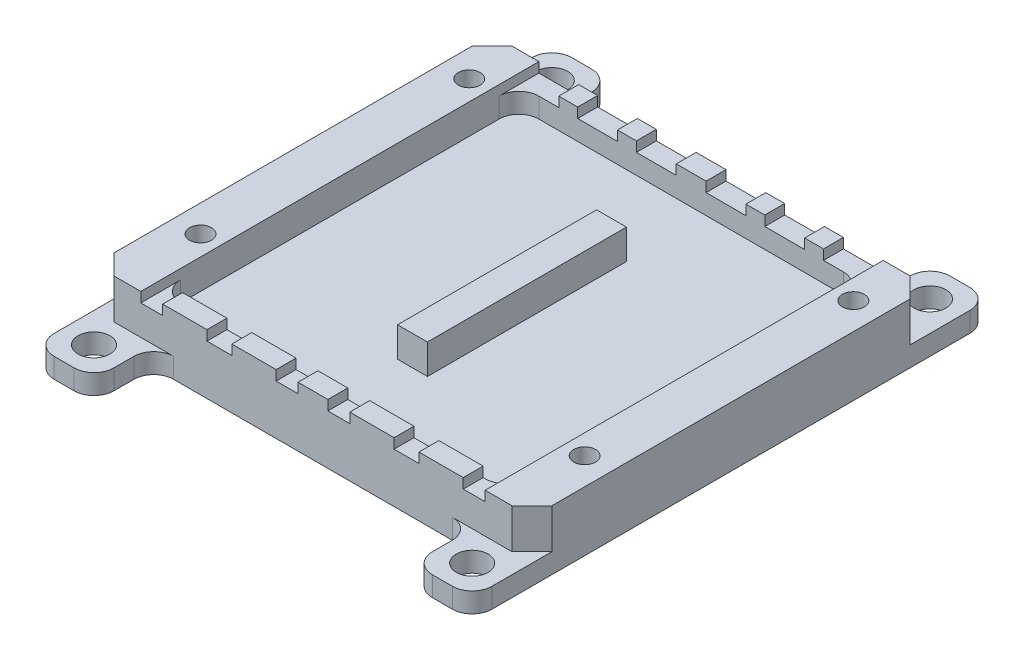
SolidWorks part; units mm, degrees
ref_plane "前视基准面" through (0, 0, 0) normal (0, 0, 1) x (1, 0, 0)
ref_plane "上视基准面" through (0, 0, 0) normal (0, 1, 0) x (1, 0, 0)
ref_plane "右视基准面" through (0, 0, 0) normal (1, 0, 0) x (0, 0, -1)
sketch "草图1" plane through (0, 0, 0) normal (0, 1, 0) x (1, 0, 0)
  line L0 (-37.9487, 0) -> (36.8091, 0) construction
  line L1 (0, 33.7892) -> (0, -25.2422) construction
  line L2 (22, 20) -> (22, 26)
  line L3 (-16, 20) -> (16, 20)
  line L4 (-22, 20) -> (-22, -20)
  line L5 (-16, -20) -> (16, -20)
  line L6 (22, 20) -> (22, -20)
  line L7 (-22, 20) -> (22, -20) construction
  line L8 (-22, -20) -> (22, 20) construction
  line L9 (16, 20) -> (16, 26)
  line L10 (-22, 20) -> (-22, 26)
  line L11 (-22, 26) -> (-16, 26)
  line L12 (-16, 20) -> (-16, 26)
  line L13 (22, 26) -> (16, 26)
  line L14 (22, -20) -> (22, -26)
  line L15 (16, -20) -> (16, -26)
  line L16 (-22, -20) -> (-22, -26)
  line L17 (-16, -20) -> (-16, -26)
  line L18 (22, -26) -> (16, -26)
  line L19 (-22, -26) -> (-16, -26)
  circle A0 centre (19, 23) radius 1.6
  circle A1 centre (-19, 23) radius 1.6
  circle A2 centre (-19, -23) radius 1.6
  circle A3 centre (19, -23) radius 1.6
  point P5 (0, 0)
  point P36 (22, 23)
  dimension "D6" = 3.2
  dimension "D1" = 40
  dimension "D2" = 44
  dimension "D3" = 6
  dimension "D4" = 6
  dimension "D5" = 20
  dimension "D7" = 3
  dimension "D8" = 3
  dimension "D9" = 3
  dimension "D10" = 3
extrude "凸台-拉伸1" add sketch "草图1" along normal blind 2
fillet "圆角1" radius 2 12 edges at (16, 1, 20) (-16, 1, 20) (-16, 1, 26) (-22, 1, 26) (16, 1, 26) (22, 1, 26) (16, 1, -20) (-16, 1, -20) (22, 1, -26) (16, 1, -26) (-16, 1, -26) (-22, 1, -26)
sketch "草图2" plane through (0, 2, 0) normal (0, 1, 0) x (1, 0, 0)
  line L0 (22, -24) -> (22, 24) construction
  line L1 (-14, -20) -> (14, -20) construction
  line L2 (-22, 24) -> (-22, -24) construction
  line L3 (14, 20) -> (-14, 20) construction
  line L4 (22, -20) -> (22, 20)
  line L5 (-22, -20) -> (22, -20)
  line L6 (-22, 20) -> (-22, -20)
  line L7 (22, 20) -> (-22, 20)
extrude "凸台-拉伸2" add sketch "草图2" along normal blind 4
chamfer "倒角1" distance 2 angle 45 4 edges at (22, 4, -20) (22, 4, 20) (-22, 4, -20) (-22, 4, 20)
sketch "草图3" plane through (0, 6, 0) normal (0, 1, 0) x (1, 0, 0)
  line L0 (-27.5525, 0) -> (27.6913, 0) construction
  line L1 (0, 25.4358) -> (0, -26.8932) construction
  line L2 (-1.5, 10) -> (-1.5, -10)
  line L3 (1.5, 10) -> (1.5, -10)
  line L15 (17.3, 18) -> (17.3, -18)
  line L16 (-17.3, 18) -> (-17.3, -18)
  line L20 (-20, -18) -> (20, -18)
  line L21 (-17.3, -18) -> (17.3, -18)
  line L22 (-17.3, 25.4358) -> (-17.3, -26.8932) construction
  line L23 (20, 18) -> (-20, 18)
  line L24 (17.3, 18) -> (-17.3, 18)
  line L25 (17.3, 25.4358) -> (17.3, -26.8932) construction
  line L26 (-1.5, -10) -> (1.5, -10)
  line L27 (-1.5, 10) -> (1.5, 10)
  line L28 (-27.5525, 10) -> (27.6913, 10) construction
  line L29 (-1.5, 25.4358) -> (-1.5, -26.8932) construction
  line L30 (-27.5525, -10) -> (27.6913, -10) construction
  line L31 (1.5, 25.4358) -> (1.5, -26.8932) construction
  dimension "D5" = 2
  dimension "D1" = 1.5
  dimension "D2" = 1.5
  dimension "D3" = 15.8
  dimension "D4" = 15.8
  dimension "D6" = 2
  dimension "D7" = 10
  dimension "D8" = 10
extrude "切除-拉伸1" cut sketch "草图3" against normal blind 3
sketch "草图4" plane through (0, 6, 0) normal (0, 1, 0) x (1, 0, 0)
  line L0 (-27.4831, 0) -> (27.2055, 0) construction
  line L1 (0, 25.5746) -> (0, -24.6723) construction
  line L2 (17.3, -18) -> (17.3, 18) construction
  line L3 (-17.3, 18) -> (-17.3, -18) construction
  line L4 (17.3, -20) -> (17.3, -18)
  line L5 (-17.3, 20) -> (-17.3, 18)
  line L6 (20, 20) -> (-20, 20) construction
  line L7 (-20, -20) -> (20, -20) construction
  line L8 (17.3, 20) -> (13.3, 20)
  line L9 (-17.3, -20) -> (-15.1, -20)
  line L10 (-13.3, 20) -> (-13.3, 18)
  line L11 (13.3, 18) -> (13.3, 20)
  line L12 (13.3, -18) -> (13.3, 20) construction
  line L13 (-13.3, 20) -> (-13.3, -18) construction
  line L14 (17.3, 18) -> (-17.3, 18) construction
  line L15 (17.3, 18) -> (13.3, 18)
  line L16 (-17.3, -18) -> (-17.3, -20)
  line L17 (-17.3, 20) -> (-17.3, -18) construction
  line L18 (17.3, 18) -> (17.3, 20)
  line L19 (17.3, -18) -> (17.3, 20) construction
  line L21 (-1.5, 10) -> (-1.5, -10) construction
  line L22 (1.5, -10) -> (1.5, 10) construction
  line L23 (-1.5, 20) -> (-1.5, 18)
  line L24 (5.5, 18) -> (5.5, 20)
  line L25 (-5.5, 20) -> (-5.5, 18)
  line L26 (1.5, -10) -> (1.5, 10) construction
  line L27 (-5.5, 20) -> (-5.5, -10) construction
  line L28 (-1.5, 20) -> (-5.5, 20)
  line L29 (-1.5, 18) -> (-5.5, 18)
  line L30 (1.5, 18) -> (1.5, 20)
  line L31 (-1.5, 10) -> (-1.5, -10) construction
  line L33 (-1.5, 20) -> (-1.5, -10) construction
  line L34 (1.5, -20) -> (3.7, -20)
  line L35 (1.5, -18) -> (3.7, -18)
  line L36 (-9.4, 25.5746) -> (-9.4, -24.6723) construction
  line L37 (9.4, 25.5746) -> (9.4, -24.6723) construction
  line L38 (7.4, 20) -> (7.4, 18)
  line L39 (11.4, 20) -> (11.4, 18)
  line L40 (-7.4, 20) -> (-7.4, 18)
  line L41 (-11.4, 20) -> (-11.4, 18)
  line L42 (-13.3, 20) -> (-17.3, 20)
  line L43 (-13.3, 18) -> (-17.3, 18)
  line L44 (-7.4, 20) -> (-11.4, 20)
  line L45 (-7.4, 18) -> (-11.4, 18)
  line L46 (5.5, 20) -> (1.5, 20)
  line L47 (5.5, 18) -> (1.5, 18)
  line L48 (11.4, 20) -> (7.4, 20)
  line L49 (11.4, 18) -> (7.4, 18)
  line L50 (-11.4, 25.5746) -> (-11.4, -24.6723) construction
  line L51 (-7.4, 25.5746) -> (-7.4, -24.6723) construction
  line L52 (7.4, 25.5746) -> (7.4, -24.6723) construction
  line L53 (11.4, 25.5746) -> (11.4, -24.6723) construction
  line L54 (-17.3, -18) -> (17.3, -18) construction
  line L55 (-17.3, -18) -> (-15.1, -18)
  line L56 (-15.1, -18) -> (-15.1, -20)
  line L57 (15.1, -20) -> (15.1, -18)
  line L58 (1.5, -18) -> (1.5, -20)
  line L59 (-1.5, -18) -> (-1.5, -20)
  line L60 (-3.7, -18) -> (-3.7, -20)
  line L61 (3.7, -18) -> (3.7, -20)
  line L62 (-10.65, -18) -> (-10.65, -20)
  line L63 (-8.15, -18) -> (-8.15, -20)
  line L64 (8.15, -18) -> (8.15, -20)
  line L65 (10.65, -18) -> (10.65, -20)
  line L66 (8.15, -18) -> (10.65, -18)
  line L67 (8.15, -20) -> (10.65, -20)
  line L68 (15.1, -18) -> (17.3, -18)
  line L69 (15.1, -20) -> (17.3, -20)
  line L70 (-3.7, -18) -> (-1.5, -18)
  line L71 (-3.7, -20) -> (-1.5, -20)
  line L72 (-10.65, -18) -> (-8.15, -18)
  line L73 (-10.65, -20) -> (-8.15, -20)
  line L74 (-10.65, 25.5746) -> (-10.65, -24.6723) construction
  line L75 (-8.15, 25.5746) -> (-8.15, -24.6723) construction
  line L76 (8.15, 25.5746) -> (8.15, -24.6723) construction
  line L77 (10.65, 25.5746) -> (10.65, -24.6723) construction
  dimension "D5" = 9.4
  dimension "D11" = 2.2
  dimension "D3" = 2
  dimension "D19" = 4
  dimension "D1" = 4
  dimension "D2" = 4
  dimension "D4" = 4
  dimension "D6" = 9.4
  dimension "D7" = 2
  dimension "D8" = 2
  dimension "D9" = 2
  dimension "D10" = 2
  dimension "D12" = 2.2
  dimension "D13" = 2.2
  dimension "D14" = 2.2
  dimension "D15" = 1.25
  dimension "D16" = 1.25
  dimension "D17" = 1.25
  dimension "D18" = 1.25
extrude "切除-拉伸2" cut sketch "草图4" against normal blind 1
fillet "圆角2" radius 2 4 edges at (17.3, 4, -18) (-17.3, 4, -18) (-17.3, 4, 18) (17.3, 4, 18)
sketch "草图5" plane through (0, 6, 0) normal (0, 1, 0) x (1, 0, 0)
  line L0 (-29.4032, 0) -> (28.1262, 0) construction
  line L1 (0, 28.1432) -> (0, -32.3448) construction
  line L8 (-22, 18) -> (-22, -18) construction
  line L9 (22, -18) -> (22, 18) construction
  circle A0 centre (19.3, 15) radius 1.1
  circle A1 centre (19.3, -12) radius 1.1
  circle A2 centre (-19.3, -12) radius 1.1
  circle A3 centre (-19.3, 15) radius 1.1
  dimension "D1" = 2.2
  dimension "D2" = 2.7
  dimension "D3" = 2.7
  dimension "D4" = 15
  dimension "D5" = 12
extrude "切除-拉伸3" cut sketch "草图5" against normal through all
sketch "草图6" plane through (0, 0, 0) normal (0, -1, 0) x (1, 0, 0)
  circle A0 centre (19.3, 12) radius 2
  circle A1 centre (-19.3, 12) radius 2
  circle A2 centre (-19.3, -15) radius 2
  circle A3 centre (19.3, -15) radius 2
  dimension "D1" = 4
extrude "切除-拉伸4" cut sketch "草图6" against normal blind 2.5
